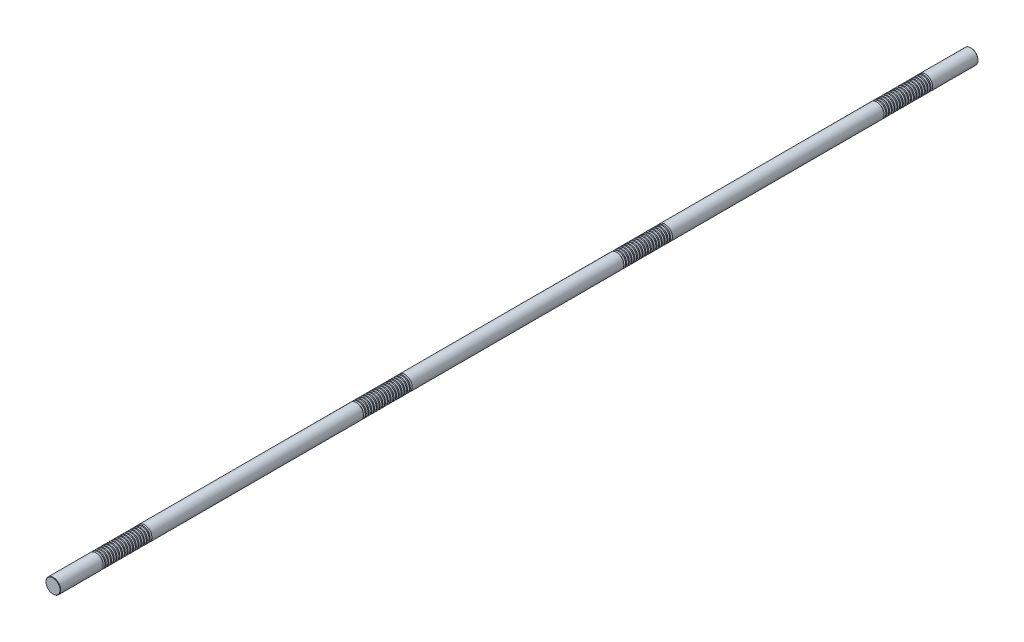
SolidWorks part; units mm, degrees
ref_plane "Front Plane" through (0, 0, 0) normal (0, 0, 1) x (1, 0, 0)
ref_plane "Top Plane" through (0, 0, 0) normal (0, 1, 0) x (1, 0, 0)
ref_plane "Right Plane" through (0, 0, 0) normal (1, 0, 0) x (0, 0, -1)
sketch "Sketch1" plane through (0, 0, 0) normal (0, 0, 1) x (1, 0, 0)
  circle A0 centre (0, 0) radius 16
  dimension "D1" = 32
extrude "Boss-Extrude1" add sketch "Sketch1" along normal mid plane 2000
chamfer "Chamfer1" distance 0.8 angle 45 2 edges at (16, 0, -1000) (16, 0, 1000)
sketch "Sketch2" plane through (0, 0, 0) normal (1, 0, 0) x (0, 0, -1)
  line L0 (900.4689, 16) -> (896.5311, 16)
  line L1 (999.2, 16) -> (-999.2, 16) construction
  line L2 (896.5311, 16) -> (897.4689, 12.5)
  line L3 (897.4689, 12.5) -> (899.5311, 12.5)
  line L4 (899.5311, 12.5) -> (900.4689, 16)
  line L5 (1000, -15.2) -> (1000, 15.2) construction
  point P4 (898.5, 16)
  point P7 (898.5, 12.5)
  point P8 (900, 14.25)
  point P9 (897, 14.25)
  dimension "D1" = 3
  dimension "D2" = 100
  dimension "D3" = 3.5
  dimension "D4" = 30
revolve "Cut-Revolve1" cut sketch "Sketch2" angle 360 about axis through (0, 0, 1000) along (0, 0, -1)
pattern_linear "LPattern1" count 18 spacing 6 along (0, 0, 1) of "Cut-Revolve1"
pattern_linear "LPattern2" count 4 spacing 567 along (0, 0, 1) of "Cut-Revolve1", "LPattern1"
